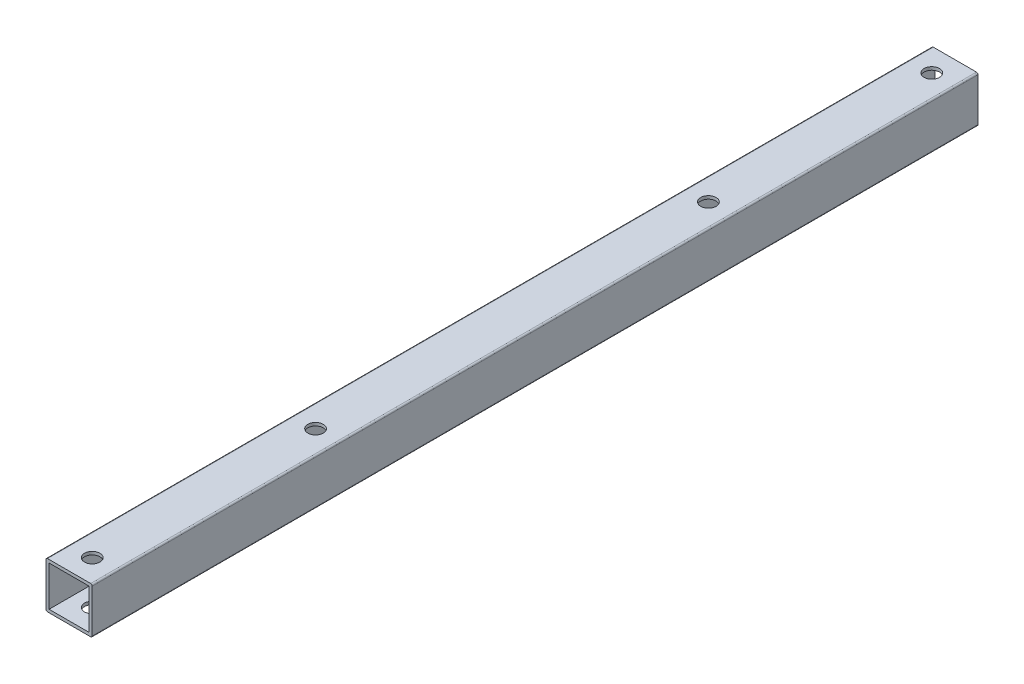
SolidWorks part; units mm, degrees
ref_plane "Plan1" through (0, 0, 0) normal (0, 0, 1) x (1, 0, 0)
ref_plane "Plan2" through (0, 0, 0) normal (0, 1, 0) x (1, 0, 0)
ref_plane "Plan3" through (0, 0, 0) normal (1, 0, 0) x (0, 0, -1)
sketch "Esquisse1" plane through (0, 0, 0) normal (0, 0, 1) x (1, 0, 0)
  line L0 (-14, 15) -> (14, 15)
  line L1 (-15, 14) -> (-15, -14)
  line L2 (14, -15) -> (-14, -15)
  line L3 (15, -14) -> (15, 14)
  line L4 (14, 14) -> (-14, -14) construction
  arc A0 (-14, -15) -> (-15, -14) centre (-14, -14) cw
  arc A1 (-15, 14) -> (-14, 15) centre (-14, 14) cw
  arc A2 (15, 14) -> (14, 15) centre (14, 14) ccw
  arc A3 (15, -14) -> (14, -15) centre (14, -14) cw
  dimension "D1" = 1
  dimension "D2" = 30
extrude "Base-Extru.-Mince" add sketch "Esquisse1" along normal blind 575 thin
sketch "Esquisse2" plane through (0, 15, 0) normal (0, 1, 0) x (-1, 0, 0)
  line L0 (14, 575) -> (-14, 575) construction
  line L1 (-14, 575) -> (14, 575) construction
  circle A0 centre (0, 15) radius 5
  circle A1 centre (0, 160) radius 5
  circle A3 centre (0, 560) radius 5
  circle A4 centre (0, 415) radius 5
  dimension "D1" = 10
  dimension "D2" = 145
  dimension "D5" = 255
  dimension "D3" = 145
  dimension "D4" = 15
  dimension "D6" = 15
extrude "Enlèv. mat.-Extru.1" cut sketch "Esquisse2" against normal blind 35
